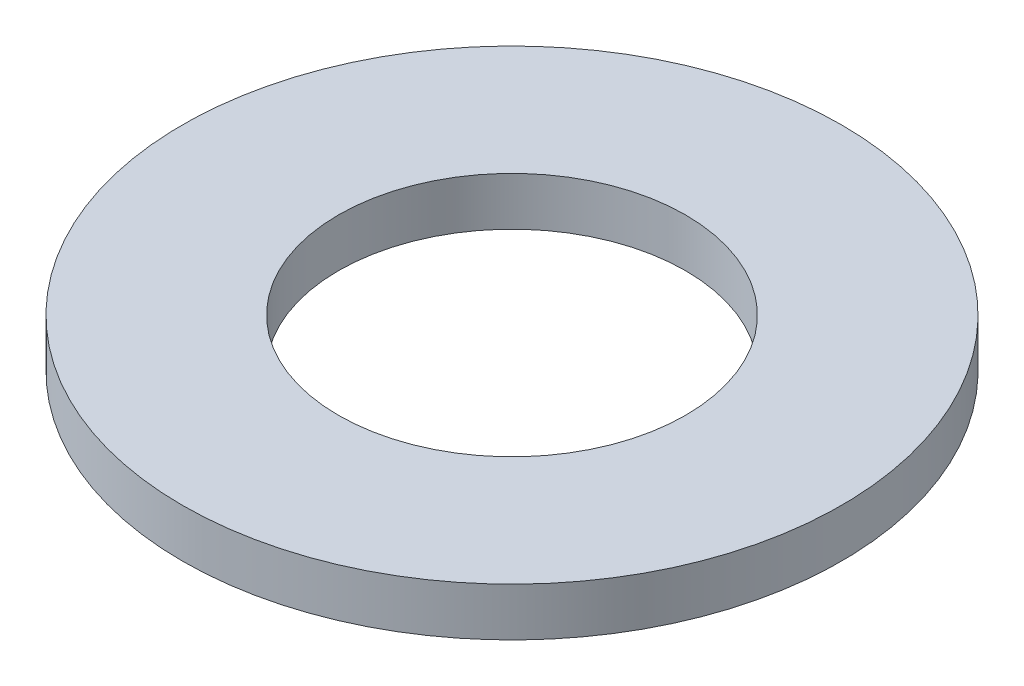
SolidWorks part; units mm, degrees
ref_plane "Front" through (0, 0, 0) normal (0, 0, 1) x (1, 0, 0)
ref_plane "Top" through (0, 0, 0) normal (0, 1, 0) x (1, 0, 0)
ref_plane "Right" through (0, 0, 0) normal (1, 0, 0) x (0, 0, -1)
sketch "Sketch1" plane through (0, 0, 0) normal (0, 1, 0) x (1, 0, 0)
  circle A0 centre (0, 0) radius 19.05
  circle A1 centre (0, 0) radius 10.033
  dimension "D1" = 38.1
  dimension "D2" = 20.066
extrude "Extrude1" add sketch "Sketch1" along normal blind 2.794
